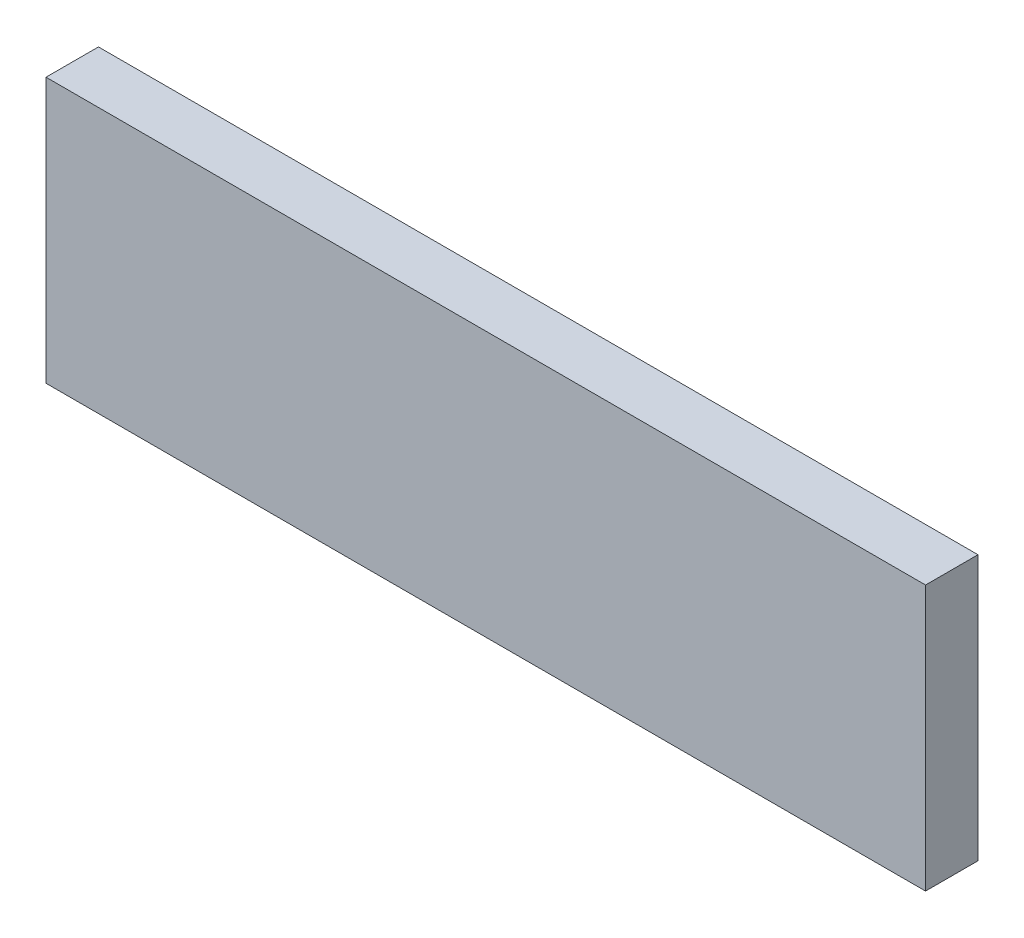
SolidWorks part; units mm, degrees
ref_plane "Ebene vorne" through (0, 0, 0) normal (0, 0, 1) x (1, 0, 0)
ref_plane "Ebene oben" through (0, 0, 0) normal (0, 1, 0) x (1, 0, 0)
ref_plane "Ebene rechts" through (0, 0, 0) normal (1, 0, 0) x (0, 0, -1)
sketch "Skizze1" plane through (0, 0, 0) normal (0, 0, 1) x (1, 0, 0)
  line L1 (-83.8403, -25.2687) -> (83.8403, -25.2687)
  line L2 (-83.8403, -25.2687) -> (-83.8403, 25.2687)
  line L3 (-83.8403, 25.2687) -> (83.8403, 25.2687)
  line L4 (83.8403, -25.2687) -> (83.8403, 25.2687)
  line L5 (-83.8403, -25.2687) -> (83.8403, 25.2687) construction
  line L6 (-83.8403, 25.2687) -> (83.8403, -25.2687) construction
  point P0 (0, 0)
extrude "Aufsatz-Linear austragen1" add sketch "Skizze1" along normal blind 10
